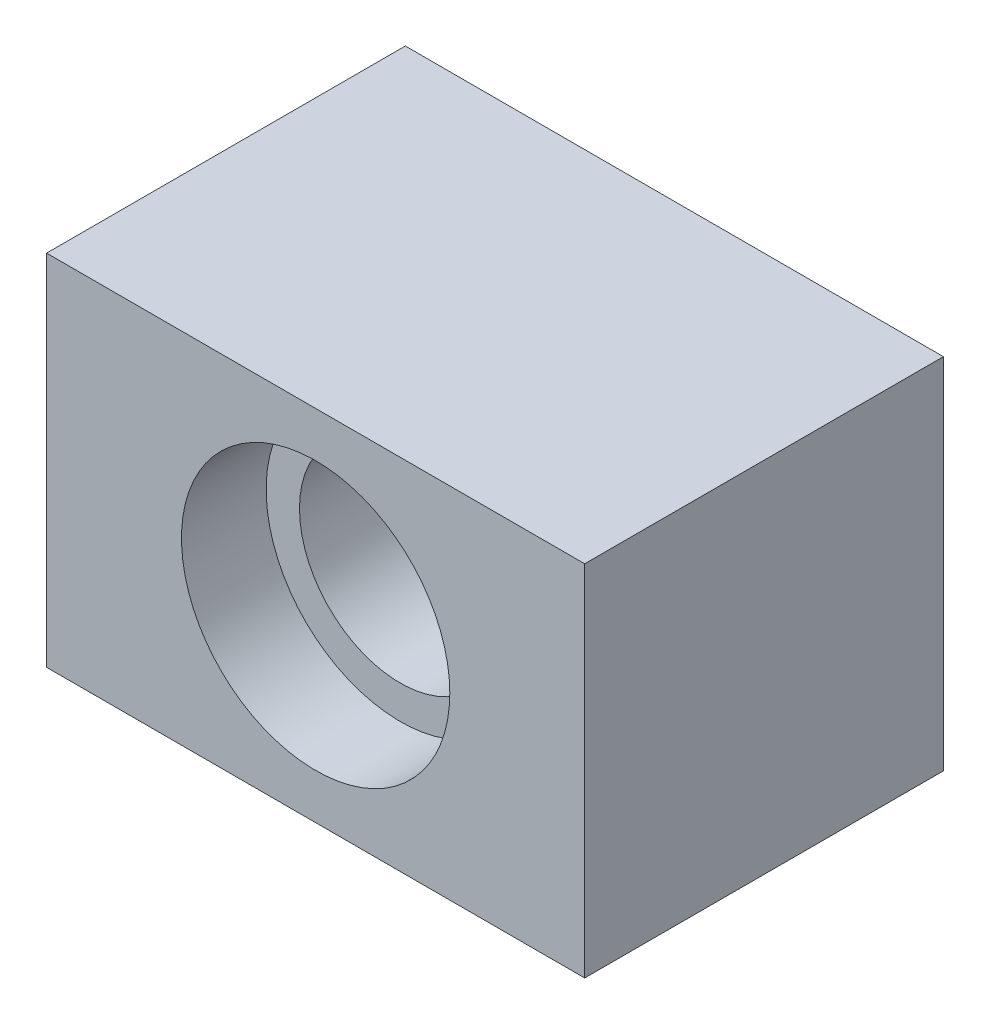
SolidWorks part; units mm, degrees
ref_plane "Front Plane" through (0, 0, 0) normal (0, 0, 1) x (1, 0, 0)
ref_plane "Top Plane" through (0, 0, 0) normal (0, 1, 0) x (1, 0, 0)
ref_plane "Right Plane" through (0, 0, 0) normal (1, 0, 0) x (0, 0, -1)
sketch "Sketch1" plane through (0, 0, 0) normal (0, 0, 1) x (1, 0, 0)
  line L0 (-19.05, -12.7) -> (19.05, -12.7)
  line L1 (19.05, -12.7) -> (19.05, 12.7)
  line L2 (19.05, 12.7) -> (-19.05, 12.7)
  line L3 (-19.05, 12.7) -> (-19.05, -12.7)
  line L4 (0, 0) -> (9.5, 0) construction
  line L5 (0, 0) -> (0, 9.5) construction
  circle A0 centre (0, 0) radius 9.5
  circle A1 centre (0, 0) radius 7.1374
  circle A2 centre (-14.2748, -6.35) radius 3.175
  circle A3 centre (14.2748, 6.35) radius 3.175
  dimension "D1" = 19
  dimension "D2" = 14.2748
  dimension "D5" = 6.35
  dimension "D3" = 25.4
  dimension "D4" = 38.1
  dimension "D6" = 6.35
  dimension "D7" = 6.35
  dimension "D8" = 14.2748
  dimension "D9" = 14.2748
sketch "Sketch2" plane through (0, 0, 0) normal (0, 0, 1) x (1, 0, 0)
  line L0 (-19.05, -12.7) -> (19.05, -12.7) construction
  line L1 (19.05, -12.7) -> (19.05, 12.7) construction
  line L2 (19.05, 12.7) -> (-19.05, 12.7) construction
  line L3 (-19.05, 12.7) -> (-19.05, -12.7) construction
  line L4 (-19.05, -12.7) -> (19.05, -12.7)
  line L5 (19.05, -12.7) -> (19.05, 12.7)
  line L6 (19.05, 12.7) -> (-19.05, 12.7)
  line L7 (-19.05, 12.7) -> (-19.05, -12.7)
  circle A0 centre (0, 0) radius 7.1374 construction
  circle A1 centre (0, 0) radius 7.1374
extrude "Boss-Extrude1" add sketch "Sketch2" along normal mid plane 25.4
sketch "Sketch3" plane through (0, 0, 0) normal (0, 0, 1) x (1, 0, 0)
  circle A0 centre (0, 0) radius 9.5 construction
  circle A1 centre (0, 0) radius 9.5
extrude "Cut-Extrude1" cut sketch "Sketch3" against normal blind 5.9944 from surface at 12.7
sketch "Sketch4" plane through (0, 0, 0) normal (0, 0, 1) x (1, 0, 0)
  circle A0 centre (0, 0) radius 9.5 construction
  circle A1 centre (0, 0) radius 9.5
extrude "Cut-Extrude2" cut sketch "Sketch4" along normal blind 5.9944 from surface at -12.7
sketch "Sketch5" plane through (0, 0, 0) normal (0, 0, 1) x (1, 0, 0)
  circle A0 centre (-14.2748, -6.35) radius 3.175 construction
  circle A1 centre (14.2748, 6.35) radius 3.175 construction
  circle A2 centre (-14.2748, -6.35) radius 3.175
  circle A3 centre (14.2748, 6.35) radius 3.175
extrude "Cut-Extrude3" cut sketch "Sketch5" against normal blind 17.2974 and the other way blind 2.54
